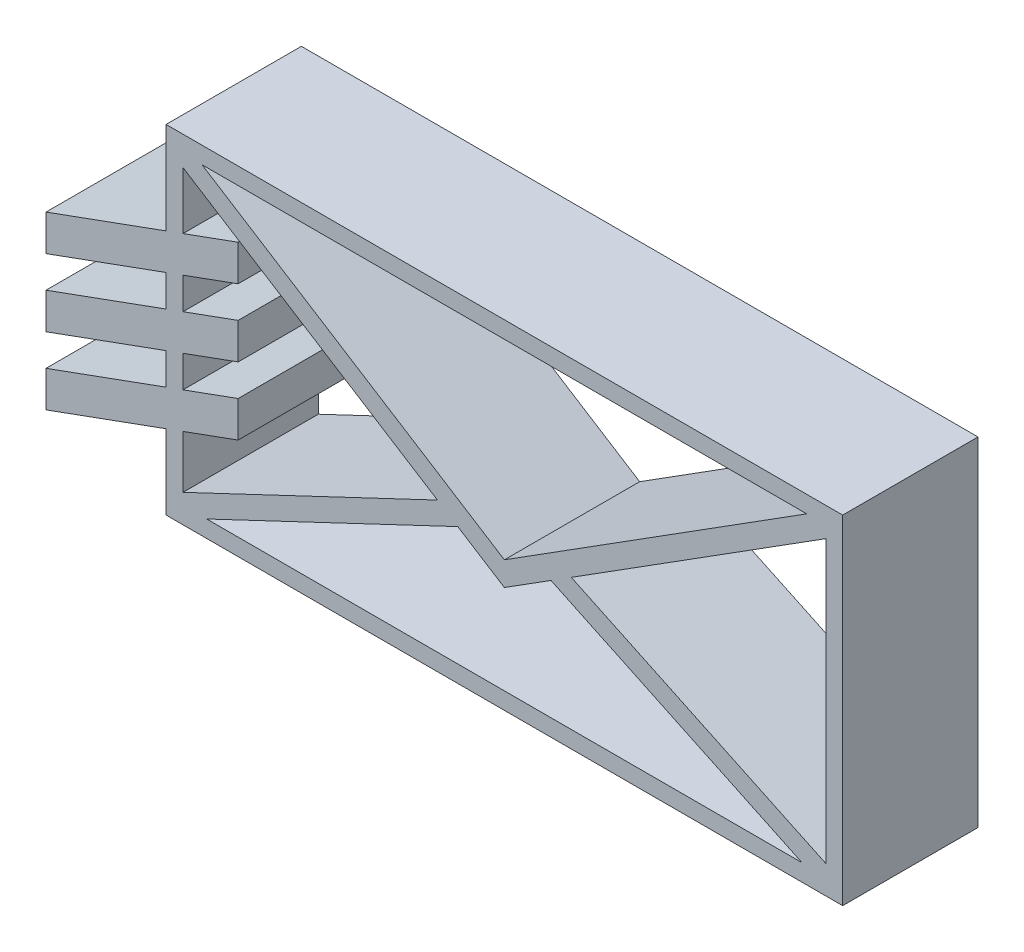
SolidWorks part; units mm, degrees
ref_plane "Ebene vorne" through (0, 0, 0) normal (0, 0, 1) x (1, 0, 0)
ref_plane "Ebene oben" through (0, 0, 0) normal (0, 1, 0) x (1, 0, 0)
ref_plane "Ebene rechts" through (0, 0, 0) normal (1, 0, 0) x (0, 0, -1)
sketch "Skizze1" plane through (0, 0, 0) normal (0, 0, 1) x (1, 0, 0)
  line L0 (-4.75, -2.25) -> (-4.75, 2.25)
  line L1 (5, -2.5) -> (-5, -2.5)
  line L2 (5, -2.5) -> (5, 2.5)
  line L3 (5, 2.5) -> (-5, 2.5)
  line L4 (-5, -2.5) -> (-5, 2.5)
  line L5 (5, -2.5) -> (-5, 2.5) construction
  line L6 (5, 2.5) -> (-5, -2.5) construction
  line L7 (4.75, 2.25) -> (-4.75, 2.25)
  line L8 (4.75, -2.25) -> (4.75, 2.25)
  line L9 (4.75, -2.25) -> (-4.75, -2.25)
  point P0 (0, 0)
  dimension "D1" = 5
  dimension "D2" = 10
  dimension "D3" = 0.25
extrude "Linear austragen1" add sketch "Skizze1" along normal blind 2
sketch "Skizze2" plane through (0, 0, 2) normal (0, 0, 1) x (1, 0, 0)
  line L0 (0, 0) -> (0, -1.2012) construction
  line L1 (0, -0.75) -> (4.75, 2.25) construction
  line L2 (0, -0.9274) -> (0.6889, -0.4923)
  line L3 (0, -0.5726) -> (4.4691, 2.25)
  line L4 (4.75, 2.25) -> (-4.75, 2.25) construction
  line L5 (4.75, -2.25) -> (4.75, 2.25) construction
  line L6 (4.75, 2.25) -> (4.4691, 2.25)
  line L7 (4.75, 2.0726) -> (4.75, 2.25)
  line L8 (0.0801, -0.8768) -> (4.8301, 2.1232) construction
  line L9 (-0.0801, -0.6232) -> (4.6699, 2.3768) construction
  line L10 (-4.75, 2.25) -> (-4.4691, 2.25)
  line L11 (-4.75, 2.0726) -> (-4.75, 2.25)
  line L12 (0, -0.5726) -> (-4.4691, 2.25)
  line L13 (0, -0.9274) -> (-0.6889, -0.4923)
  line L14 (-0.8391, -0.3975) -> (-4.75, -2.25) construction
  line L15 (-0.9893, -0.3026) -> (-4.75, -2.084)
  line L17 (-0.6889, -0.4923) -> (-4.3996, -2.25)
  line L19 (0, 0) -> (-4.75, -2.25) construction
  line L20 (-0.0642, 0.1356) -> (-4.8142, -2.1144) construction
  line L21 (-0.9893, -0.3026) -> (-4.75, 2.0726)
  line L23 (-4.75, -2.25) -> (4.75, -2.25) construction
  line L25 (-4.75, -2.25) -> (-4.3996, -2.25)
  line L26 (-4.75, -2.084) -> (-4.75, -2.25)
  line L27 (4.75, -2.084) -> (4.75, -2.25)
  line L28 (4.75, -2.25) -> (4.3996, -2.25)
  line L29 (0.8391, -0.3975) -> (4.75, -2.25) construction
  line L30 (0.6889, -0.4923) -> (4.3996, -2.25)
  line L31 (0.9893, -0.3026) -> (4.75, -2.084)
  line L32 (0.9893, -0.3026) -> (4.75, 2.0726)
  dimension "D1" = 0.75
  dimension "D2" = 0.15
  dimension "D3" = 0.15
  dimension "D4" = 0.15
extrude "Linear austragen2" add sketch "Skizze2" against normal blind 2
sketch "Skizze3" plane through (0, 0, 2) normal (0, 0, 1) x (1, 0, 0)
  line L0 (-6.6892, -1.7439) -> (-4.0205, -0.7726) construction
  line L1 (-5, -2.5) -> (5, -2.5) construction
  line L2 (-6.7747, -2.0411) -> (-3.935, -1.0075)
  line L3 (-6.7747, -1.509) -> (-3.935, -0.4755)
  line L4 (-6.7747, -1.509) -> (-6.7747, -2.0411)
  line L5 (-3.935, -1.0075) -> (-3.935, -0.4755)
  line L6 (-6.7747, -1.509) -> (-4.106, -0.5377) construction
  line L7 (-6.6037, -1.9789) -> (-3.935, -1.0075) construction
  dimension "D1" = 20
  dimension "D2" = 0.25
  dimension "D3" = 0.25
extrude "Linear austragen3" add sketch "Skizze3" against normal blind 2
pattern_linear "Lineares Muster1" count 3 spacing 1 along (0, 1, 0) of "Linear austragen3"
